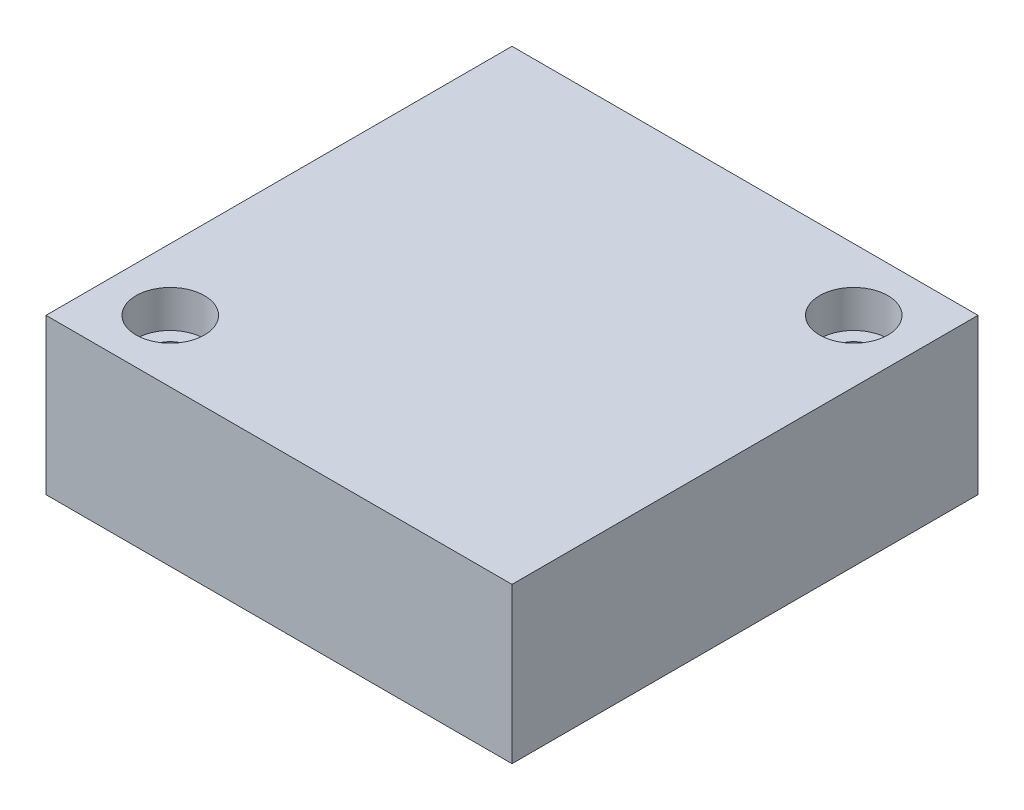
SolidWorks part; units mm, degrees
ref_plane "Front Plane" through (0, 0, 0) normal (0, 0, 1) x (1, 0, 0)
ref_plane "Top Plane" through (0, 0, 0) normal (0, 1, 0) x (1, 0, 0)
ref_plane "Right Plane" through (0, 0, 0) normal (1, 0, 0) x (0, 0, -1)
sketch "Sketch1" plane through (0, 0, 0) normal (0, 1, 0) x (1, 0, 0)
  line L1 (-37.5, -37.5) -> (37.5, -37.5)
  line L2 (-37.5, -37.5) -> (-37.5, 37.5)
  line L3 (-37.5, 37.5) -> (37.5, 37.5)
  line L4 (37.5, -37.5) -> (37.5, 37.5)
  line L5 (-37.5, -37.5) -> (37.5, 37.5) construction
  line L6 (-37.5, 37.5) -> (37.5, -37.5) construction
  point P0 (0, 0)
  dimension "D1" = 75
  dimension "D2" = 75
extrude "Boss-Extrude1" add sketch "Sketch1" along normal blind 25
sketch "Sketch2" plane through (0, 25, 0) normal (0, 1, 0) x (1, 0, 0)
  line L0 (37.5, 37.5) -> (-37.5, 37.5) construction
  line L1 (37.5, -37.5) -> (37.5, 37.5) construction
  line L2 (-37.5, 37.5) -> (-37.5, -37.5) construction
  line L3 (-37.5, -37.5) -> (37.5, -37.5) construction
  point P0 (-27.5, -27.5)
  point P1 (27.5, 27.5)
  dimension "D1" = 10
  dimension "D2" = 10
  dimension "D3" = 10
  dimension "D4" = 10
hole_wizard "CBORE for M6 SHCS1" positions "Sketch2" profile "Sketch3" counterbore size "M6" standard "ANSI Metric"
sketch "Sketch3" plane through (-27.5, 25, 27.5) normal (1, 0, 0) x (0, 0, 1)
  line L0 (0, 0) -> (0, 25)
  line L1 (0, 25) -> (3.3, 25)
  line L3 (3.3, 25) -> (3.3, 6)
  line L4 (3.3, 6) -> (5.5, 6)
  line L5 (5.5, 6) -> (5.5, 0)
  line L7 (5.5, 0) -> (0, 0)
  line L11 (0, -6.35) -> (0, 107.95) construction
  dimension "Thru Hole Dia." = 6.6
  dimension "Thru Hole Depth" = 25
  dimension "C'Bore Dia." = 11
  dimension "C'Bore Depth" = 6
